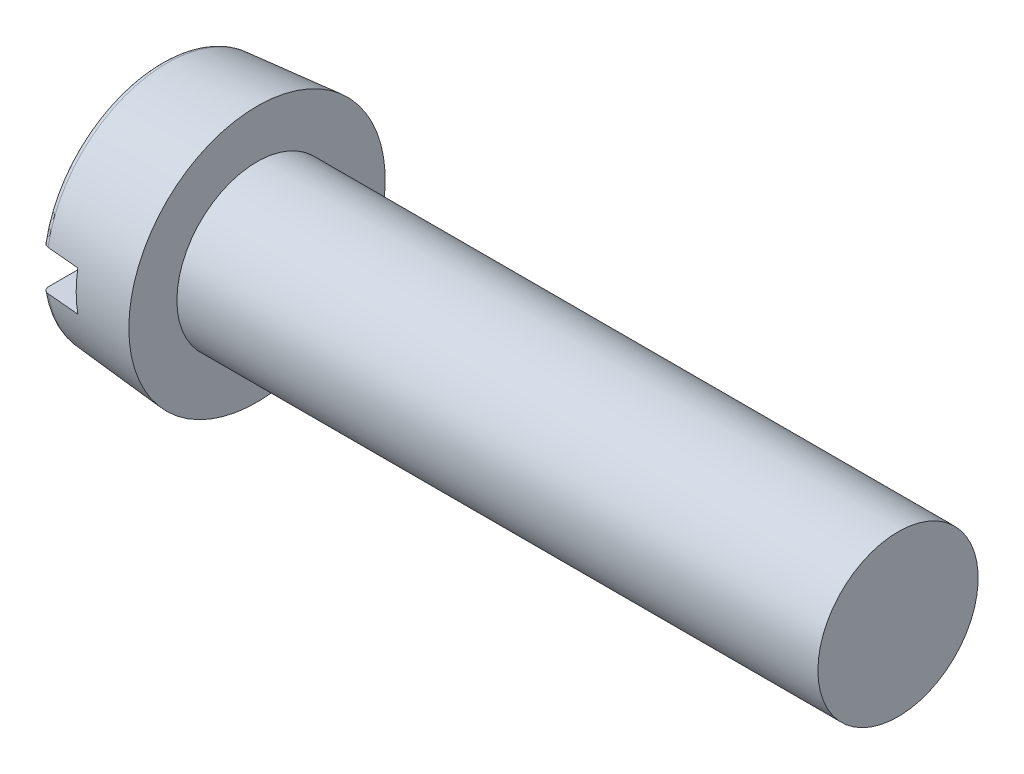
SolidWorks part; units mm, degrees
ref_plane "Front Plane" through (0, 0, 0) normal (0, 0, 1) x (1, 0, 0)
ref_plane "Top Plane" through (0, 0, 0) normal (0, 1, 0) x (1, 0, 0)
ref_plane "Right Plane" through (0, 0, 0) normal (1, 0, 0) x (0, 0, -1)
sketch "BodySke" plane through (0, 0, 0) normal (0, 0, 1) x (1, 0, 0)
  line L0 (0, 0) -> (111.3824, 0) construction
  line L1 (0, 0) -> (0, 7.4751)
  line L2 (0, 7.4751) -> (6, 8)
  line L3 (6, 8) -> (6, 5)
  line L4 (6, 5) -> (46, 5)
  line L5 (46, 5) -> (46, 0)
  line L6 (7.5, 8.824) -> (7.5, -5.8939) construction
  line L7 (0, 0) -> (46, 0)
  line L8 (8, 8.824) -> (8, -4.958) construction
  point P10 (46, 4.172)
  dimension "Diameter" = 10
  dimension "Head_dia" = 16
  dimension "Head_height" = 6
  dimension "Head_side_angle" = 5
  dimension "Length" = 40
  dimension "Advance" = 1.5
  dimension "Thread_minor" = 8.344
  dimension "Thread_length" = 38
revolve "BaseBody" add sketch "BodySke" angle 360 about L0
fillet "Fillet1" radius 0.4 1 edges at (0, 0, 7.4751)
sketch "SlotSke" plane through (0, 0, 0) normal (-1, 0, 0) x (0, 0, 1)
  line L1 (-8, 1.25) -> (8, 1.25)
  line L2 (-8, 1.25) -> (-8, -1.25)
  line L3 (-8, -1.25) -> (8, -1.25)
  line L4 (8, 1.25) -> (8, -1.25)
  dimension "D1" = 16
  dimension "D2" = 8
  dimension "D3" = 1.25
  dimension "Slot_width" = 2.5
extrude "Slot" cut sketch "SlotSke" against normal blind 2.4
sketch "ThdSchSke" plane through (0, 0, 0) normal (0, 0, 1) x (1, 0, 0)
  line L0 (0, 0) -> (55.1256, 0) construction
  line L1 (0, 0) -> (111.3824, 0) construction
  line L2 (45.522, 5) -> (45.522, 5.9561)
  line L3 (45.522, 5.9561) -> (46.478, 5.9561)
  line L4 (46.478, 5.9561) -> (46.478, 5)
  line L5 (46.478, 5) -> (46, 4.172)
  line L6 (46, 4.172) -> (45.522, 5)
  line L7 (6, 5) -> (46, 5) construction
  line L13 (46, 5) -> (46, 0) construction
revolve "ThreadSchematic" [suppressed] cut sketch "ThdSchSke" angle 360 about L0
pattern_linear "ThdSchPat" [suppressed] count 25 along (1, 0, 0)
equation "\"Thread_minor@ThreadCosmetic\" = \"Thread_minor@BodySke\""
equation "\"D1@SlotSke\" = \"Head_dia@BodySke\""
equation "\"D2@SlotSke\" = \"D1@SlotSke\" / 2"
equation "\"D3@SlotSke\" = \"Slot_width@SlotSke\" / 2"
equation "\"Advance@ThdSchPat\" = \"Advance@BodySke\""
equation "\"D1@ThdSchPat\" =  int( \"Thread_length@BodySke\" / \"Advance@ThdSchPat\" ) "
